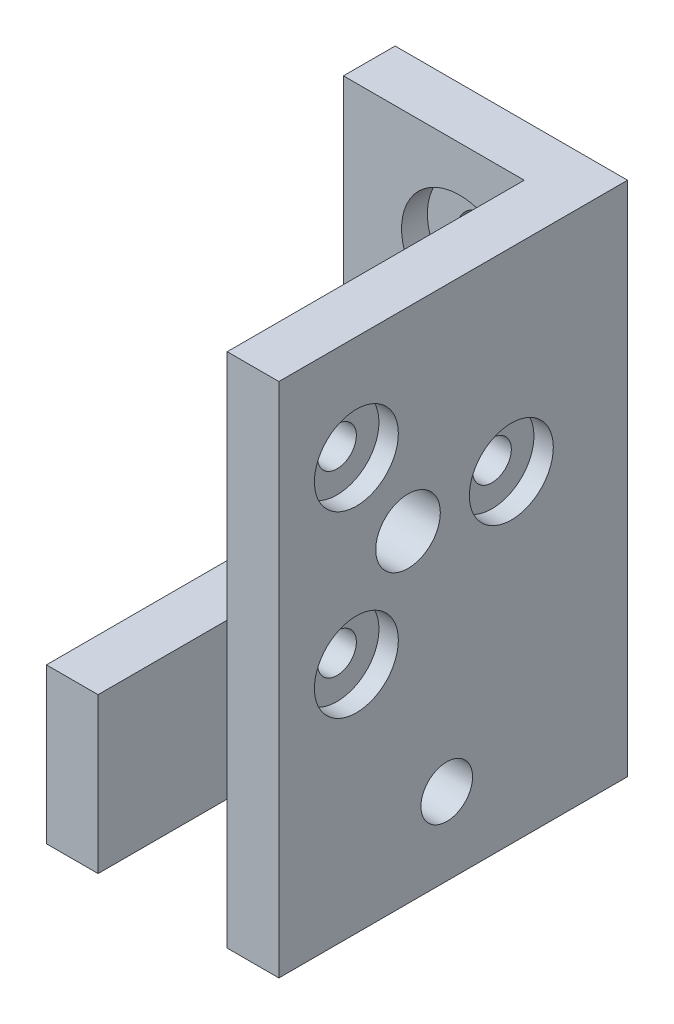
SolidWorks part; units mm, degrees
ref_plane "Plan de face" through (0, 0, 0) normal (0, 0, 1) x (1, 0, 0)
ref_plane "Plan de dessus" through (0, 0, 0) normal (0, 1, 0) x (1, 0, 0)
ref_plane "Plan de droite" through (0, 0, 0) normal (1, 0, 0) x (0, 0, -1)
sketch "Esquisse1" plane through (0, 0, 0) normal (0, 0, 1) x (1, 0, 0)
  line L1 (0, 0) -> (18, 0)
  line L2 (0, 0) -> (0, 40)
  line L3 (0, 40) -> (18, 40)
  line L4 (18, 0) -> (18, 40)
  dimension "D1" = 40
  dimension "D2" = 18
extrude "Boss.-Extru.1" add sketch "Esquisse1" along normal blind 4
sketch "Esquisse2" plane through (0, 0, 4) normal (0, 0, 1) x (1, 0, 0)
  line L0 (0, 0) -> (18, 0) construction
  line L1 (0, 0) -> (4, 0)
  line L2 (0, 0) -> (0, 12)
  line L3 (0, 12) -> (4, 12)
  line L4 (4, 0) -> (4, 12)
  line L5 (18, 40) -> (14, 40)
  line L6 (18, 40) -> (18, 0)
  line L7 (18, 0) -> (14, 0)
  line L8 (14, 40) -> (14, 0)
  dimension "D1" = 4
  dimension "D2" = 4
  dimension "D3" = 12
extrude "Boss.-Extru.2" add sketch "Esquisse2" along normal blind 23
sketch "Esquisse4" plane through (0, 0, 0) normal (-1, 0, 0) x (0, 0, 1)
  line L0 (27, 0) -> (0, 0) construction
  line L1 (27, 12) -> (27, 0) construction
  circle A0 centre (14, 6) radius 2
  dimension "D2" = 4
  dimension "D3" = 6
  dimension "D4" = 13
extrude "Enlèv. mat.-Extru.1" cut sketch "Esquisse4" against normal through all
sketch "Esquisse6" plane through (0, 0, 4) normal (0, 0, 1) x (1, 0, 0)
  line L0 (0, 40) -> (0, 12) construction
  line L1 (14, 40) -> (0, 40) construction
  circle A0 centre (9, 32) radius 2.25
  dimension "D2" = 4.5
  dimension "D1" = 9
  dimension "D3" = 8
extrude "Enlèv. mat.-Extru.2" cut sketch "Esquisse6" against normal blind 10
pattern_linear "Répétition linéaire1" count 2 spacing 24 along (0, -1, 0) of "Enlèv. mat.-Extru.2"
sketch "Esquisse7" plane through (18, 0, 0) normal (1, 0, 0) x (0, 0, -1)
  line L0 (-17, 24.9642) -> (-17, -13.1334) construction
  line L1 (-27, 0) -> (-27, 40) construction
  circle A0 centre (-14, 6) radius 8.8 construction
  circle A1 centre (-17, 24.9642) radius 8.8 construction
  circle A2 centre (-14, 6) radius 10.4 construction
  dimension "D1" = 17.6
  dimension "D2" = 17.6
  dimension "D3" = 20.8
  dimension "D4" = 10
sketch "Esquisse8" plane through (18, 0, 0) normal (1, 0, 0) x (0, 0, -1)
  circle A0 centre (-17, 24.9642) radius 2.5
  dimension "D1" = 5
extrude "Enlèv. mat.-Extru.3" cut sketch "Esquisse8" against normal blind 10
sketch "Esquisse9" plane through (14, 0, 0) normal (-1, 0, 0) x (0, 0, 1)
  circle A0 centre (21, 31.8924) radius 1.5
  circle A1 centre (9, 24.9642) radius 1.5
  circle A2 centre (21, 18.036) radius 1.5
extrude "Enlèv. mat.-Extru.4" cut sketch "Esquisse9" against normal blind 10
sketch "Esquisse10" plane through (18, 0, 0) normal (1, 0, 0) x (0, 0, -1)
  circle A6 centre (-21, 31.8924) radius 3.25
  circle A7 centre (-9, 24.9642) radius 3.25
  circle A8 centre (-21, 18.036) radius 3.25
  dimension "D1" = 6.5
extrude "Enlèv. mat.-Extru.5" cut sketch "Esquisse10" against normal blind 1.5
sketch "Esquisse11" plane through (0, 0, 4) normal (0, 0, 1) x (1, 0, 0)
  circle A0 centre (9, 32) radius 4.5
  circle A1 centre (9, 8) radius 4.5
  dimension "D1" = 9
  dimension "D2" = 9
extrude "Enlèv. mat.-Extru.6" cut sketch "Esquisse11" against normal blind 2
